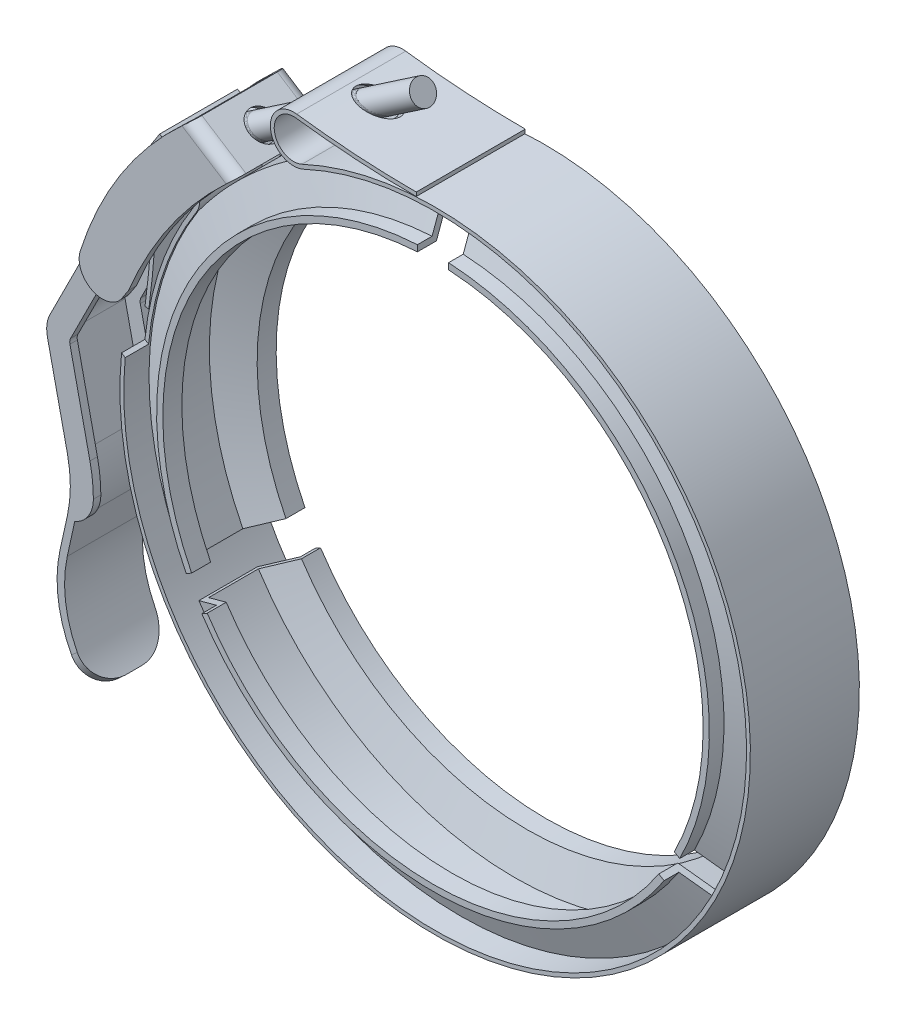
SolidWorks part; units mm, degrees
ref_plane "Front" through (0, 0, 0) normal (0, 0, 1) x (1, 0, 0)
ref_plane "Top" through (0, 0, 0) normal (0, 1, 0) x (1, 0, 0)
ref_plane "Right" through (0, 0, 0) normal (1, 0, 0) x (0, 0, -1)
sketch "Sketch1" plane through (0, 0, 0) normal (1, 0, 0) x (0, 0, -1)
  line L0 (-11.557, 56.3626) -> (-8.5671, 56.3626)
  line L1 (-11.1125, 64.2874) -> (11.1125, 64.2874)
  line L2 (-11.1125, 64.2874) -> (-11.1125, 63.5)
  line L3 (-11.1125, 63.5) -> (-5.9693, 63.5)
  line L4 (8.5671, 56.3626) -> (5.9693, 63.5)
  line L5 (-8.5671, 56.3626) -> (-5.9693, 63.5)
  line L6 (11.1125, 64.2874) -> (11.1125, 63.5)
  line L7 (11.557, 56.3626) -> (8.5671, 56.3626)
  line L8 (5.9693, 63.5) -> (11.1125, 63.5)
  line L9 (0, 0) -> (0, -21.5186) construction
  line L10 (-11.557, 55.0926) -> (-7.6778, 55.0926)
  line L11 (-7.6778, 55.0926) -> (-5.08, 62.23)
  line L12 (-5.08, 62.23) -> (5.08, 62.23)
  line L13 (-7.6778, 55.0926) -> (-4.7934, 63.0174) construction
  line L14 (7.6778, 55.0926) -> (4.7934, 63.0174) construction
  line L15 (-11.557, 56.3626) -> (-11.557, 55.0926)
  line L16 (11.557, 56.3626) -> (11.557, 55.0926)
  line L17 (7.6778, 55.0926) -> (5.08, 62.23)
  line L18 (11.557, 55.0926) -> (7.6778, 55.0926)
  line L19 (-4.7934, 63.0174) -> (4.7934, 63.0174) construction
  line L20 (-4.7934, 63.0174) -> (-4.7934, 63.0174) construction
  line L21 (-4.7934, 63.0174) -> (-4.7934, 63.0174) construction
  line L22 (4.7934, 63.0174) -> (4.7934, 63.0174) construction
  line L23 (4.7934, 63.0174) -> (4.7934, 63.0174) construction
  line L24 (0, 0) -> (-16.4298, 0) construction
  dimension "D2" = 0.7874
  dimension "D3" = 22.225
  dimension "D4" = 1.27
  dimension "D5" = 40
  dimension "D6" = 23.114
  dimension "D7" = 7.1374
  dimension "D8" = 10.16
  dimension "D9" = 62.23
  dimension "D1" = 1.27
revolve "Revolve1" add sketch "Sketch1" angle 360 about L24
sketch "Sketch2" plane through (0, 0, 0) normal (0, 0, 1) x (1, 0, 0)
  line L0 (0, 0) -> (0, 63.4206) construction
  line L1 (0, 0) -> (-54.9238, -31.7103) construction
  line L2 (0, 0) -> (54.9238, -31.7103) construction
  line L3 (-1.5875, 2.7496) -> (-56.5113, -28.9607) construction
  line L4 (-3.175, 1.8331) -> (-56.5113, -28.9607)
  line L5 (0, -3.6662) -> (53.3363, -34.4599)
  line L6 (3.175, 1.8331) -> (3.175, 63.4206)
  line L7 (0, -3.6662) -> (-53.3363, -34.4599)
  line L8 (3.175, 1.8331) -> (56.5113, -28.9607)
  line L9 (-3.175, 1.8331) -> (-3.175, 63.4206)
  line L10 (-3.175, 0) -> (-3.175, 63.4206) construction
  line L11 (3.175, 0) -> (3.175, 63.4206) construction
  line L12 (1.5875, 2.7496) -> (56.5113, -28.9607) construction
  line L13 (-1.5875, -2.7496) -> (53.3363, -34.4599) construction
  line L14 (1.5875, -2.7496) -> (-53.3363, -34.4599) construction
  circle A0 centre (0, 0) radius 63.5 construction
  circle A2 centre (0, 0) radius 63.5 construction
  arc A3 (53.3363, -34.4599) -> (56.5113, -28.9607) centre (0, 0) ccw
  arc A4 (-56.5113, -28.9607) -> (-53.3363, -34.4599) centre (0, 0) ccw
  arc A5 (3.175, 63.4206) -> (-3.175, 63.4206) centre (0, 0) ccw
  dimension "D1" = 120
  dimension "D2" = 120
  dimension "D5" = 3.175
extrude "Cut-Extrude1" cut sketch "Sketch2" against normal mid plane 25.4
sketch "Sketch3" plane through (0, 0, 11.1125) normal (0, 0, 1) x (1, 0, 0)
  line L0 (0, 0) -> (-42.761, 77.141) construction
  line L1 (0, 0) -> (0, 69.6657) construction
  line L2 (-3.8544, 64.2226) -> (-3.8544, 65.01)
  line L3 (0, 63.5) -> (0, 64.2874)
  line L4 (-62.9436, 8.388) -> (-63.7241, 8.492)
  line L5 (-63.151, 12.3029) -> (-63.9315, 12.4069)
  line L6 (0, 0) -> (-28.849, 61.8668) construction
  line L7 (0, 0) -> (-57.5139, 36.7684) construction
  line L8 (0, 0) -> (-66.7293, 8.8925) construction
  circle A0 centre (-28.849, 61.8668) radius 3.9751 construction
  circle A1 centre (0, 0) radius 64.2874 construction
  circle A2 centre (-28.849, 61.8668) radius 4.7625 construction
  circle A3 centre (0, 0) radius 63.5 construction
  arc A4 (0, 64.2874) -> (-27.169, 58.2642) centre (0, 0) ccw
  arc A5 (0, 63.5) -> (-26.8363, 57.5505) centre (0, 0) ccw
  arc A6 (-28.2345, 66.5895) -> (-26.8363, 57.5505) centre (-28.849, 61.8668) ccw
  arc A7 (-28.3361, 65.8087) -> (-27.169, 58.2642) centre (-28.849, 61.8668) ccw
  arc A8 (-28.3361, 65.8087) -> (-3.8544, 64.2226) centre (-3.8544, 253.9591) ccw
  arc A9 (-28.2345, 66.5895) -> (-3.8544, 65.01) centre (-3.8544, 253.9591) ccw
  arc A10 (-62.2764, 36.7832) -> (-63.9315, 12.4069) centre (-251.2245, 37.3676) cw
  arc A11 (-61.489, 36.7807) -> (-63.151, 12.3029) centre (-251.2245, 37.3676) cw
  arc A12 (-61.489, 36.7807) -> (-54.1647, 34.6273) centre (-57.5139, 36.7684) cw
  arc A13 (-62.2764, 36.7832) -> (-53.5013, 34.2032) centre (-57.5139, 36.7684) cw
  arc A14 (-62.9436, 8.388) -> (-53.5013, 34.2032) centre (0, 0) cw
  arc A15 (-63.7241, 8.492) -> (-54.1647, 34.6273) centre (0, 0) cw
  arc A16 (-3.175, 63.4206) -> (-56.5113, -28.9607) centre (0, 0) ccw construction
  dimension "D1" = 9.525
  dimension "D4" = 0.0508
  dimension "D7" = 188.949
  dimension "D6" = 0.0508
  dimension "D5" = 25
  dimension "D2" = 38.1
  dimension "D8" = 25
  dimension "D9" = 3.8532
  dimension "D3" = 0.7874
extrude "Extrude3" add sketch "Sketch3" against normal blind 22.225
sketch "Sketch4" plane through (0, 0, 11.557) normal (0, 0, 1) x (1, 0, 0)
  arc A0 (-29.4542, 57.143) -> (-52.7515, 36.7444) centre (0, 0) ccw construction
  arc A2 (-29.4542, 57.143) -> (-52.7515, 36.7444) centre (0, 0) ccw
  arc A3 (-26.8363, 57.5505) -> (-53.5013, 34.2032) centre (12.416, -14.1804) ccw
  arc A4 (-28.2345, 66.5895) -> (-26.8363, 57.5505) centre (-28.849, 61.8668) ccw construction
  arc A5 (-29.4542, 57.143) -> (-26.8363, 57.5505) centre (-28.849, 61.8668) ccw
  arc A6 (-53.5013, 34.2032) -> (-62.2764, 36.7832) centre (-57.5139, 36.7684) ccw construction
  arc A7 (-53.5013, 34.2032) -> (-52.7515, 36.7444) centre (-57.5139, 36.7684) ccw
extrude "Cut-Extrude2" cut sketch "Sketch4" against normal through all
sketch "Sketch5" plane through (0, 0, 0) normal (0, 0, 1) x (1, 0, 0)
  line L0 (-57.5139, 36.7684) -> (-28.849, 61.8668) construction
  line L1 (-50.3539, 47.2576) -> (-14.4733, 71.6328) construction
  circle A0 centre (-50.3539, 47.2576) radius 3.175
  arc A1 (-54.1647, 34.6273) -> (-61.489, 36.7807) centre (-57.5139, 36.7684) ccw construction
  dimension "D1" = 6.35
  dimension "D2" = 12.7
extrude "Extrude4" add sketch "Sketch5" along normal mid plane 15.875
ref_plane "Plane1" through (-50.3539, 47.2576, 0) normal (0.8272, 0.5619, 0) x (0, 0, -1)
sketch "Sketch6" plane through (-50.3539, 47.2576, 0) normal (0.8272, 0.5619, 0) x (0, 0, -1)
  circle A0 centre (0, 0) radius 2.413
  dimension "D1" = 4.826
extrude "Extrude6" add sketch "Sketch6" along normal blind 44.45 separate body
sketch "Sketch8" plane through (0, 0, 0) normal (0, 0, 1) x (1, 0, 0)
  line L0 (0, 0) -> (-64.2016, 41.0438) construction
  arc A0 (-54.1647, 34.6273) -> (-61.489, 36.7807) centre (-57.5139, 36.7684) ccw construction
  point P3 (-57.5139, 36.7684)
  dimension "D1" = 76.2
ref_plane "Plane2" through (-64.2016, 41.0438, 0) normal (-0.8425, 0.5386, 0) x (0, 0, 1)
sketch "Sketch9" plane through (-64.2016, 41.0438, 0) normal (-0.8425, 0.5386, 0) x (0, 0, 1)
  line L1 (-15.2694, 7.8629) -> (-6.35, 7.8629)
  line L2 (-15.2694, 7.8629) -> (-15.2694, -28.9171)
  line L3 (-15.2694, -28.9171) -> (-6.35, -28.9171)
  line L4 (-6.35, 7.8629) -> (-6.35, -28.9171)
  line L5 (6.35, 7.8629) -> (13.265, 7.8629)
  line L6 (6.35, 7.8629) -> (6.35, -28.9171)
  line L7 (6.35, -28.9171) -> (13.265, -28.9171)
  line L8 (13.265, 7.8629) -> (13.265, -28.9171)
  dimension "D1" = 6.35
  dimension "D2" = 12.7
extrude "Cut-Extrude3" cut sketch "Sketch9" against normal up to surface (13.1887 mm away)
sketch "Sketch7" plane through (0, 0, 0) normal (0, 0, 1) x (1, 0, 0)
  line L0 (-50.3539, 47.2576) -> (-48.077, 49.4704) construction
  line L1 (-51.402, 52.8918) -> (-44.752, 46.049)
  line L2 (-2.5621, -3.2733) -> (-57.5139, 36.7684) construction
  line L4 (-57.5139, 36.7684) -> (-68.9871, 17.7338) construction
  arc A0 (-51.402, 52.8918) -> (-73.528, 19.1699) centre (-2.5621, -3.2733) ccw
  arc A1 (-44.752, 46.049) -> (-64.4463, 16.2978) centre (-2.5621, -3.2733) ccw
  circle A2 centre (-50.3539, 47.2576) radius 3.175 construction
  arc A3 (-73.528, 19.1699) -> (-64.4463, 16.2978) centre (-68.9871, 17.7338) ccw
  dimension "D1" = 9.525
  dimension "D2" = 22.225
  dimension "D3" = 85
sketch "Sketch10" plane through (-64.2016, 41.0438, 0) normal (-0.8425, 0.5386, 0) x (0, 0, 1)
  line L0 (8.4455, -27.0568) -> (8.4455, 15.1072)
  line L1 (7.6835, 15.8692) -> (-7.6835, 15.8692)
  line L2 (-8.4455, 15.1072) -> (-8.4455, -27.0568)
  line L3 (-8.4455, -27.0568) -> (-9.9695, -27.0568)
  line L4 (-9.9695, -27.0568) -> (-9.9695, 15.1072)
  line L5 (-7.6835, 17.3932) -> (7.6835, 17.3932)
  line L6 (9.9695, 15.1072) -> (9.9695, -27.0568)
  line L7 (9.9695, -27.0568) -> (8.4455, -27.0568)
  line L8 (7.9375, 15.8692) -> (-7.9375, 15.8692) construction
  line L9 (7.9375, 9.5192) -> (7.9375, 15.8692) construction
  line L10 (-7.9375, 15.8692) -> (-7.9375, 9.5192) construction
  arc A0 (8.4455, 15.1072) -> (7.6835, 15.8692) centre (7.6835, 15.1072) ccw
  arc A1 (-7.6835, 15.8692) -> (-8.4455, 15.1072) centre (-7.6835, 15.1072) ccw
  arc A2 (-9.9695, 15.1072) -> (-7.6835, 17.3932) centre (-7.6835, 15.1072) cw
  arc A3 (7.6835, 17.3932) -> (9.9695, 15.1072) centre (7.6835, 15.1072) cw
  dimension "D6" = 0.762
  dimension "D7" = 2.286
  dimension "D1" = 1.524
  dimension "D2" = 1.524
  dimension "D3" = 1.524
  dimension "D4" = 0.508
  dimension "D5" = 0.508
  dimension "D8" = 44.45
extrude "Extrude8" add sketch "Sketch10" against normal offset from surface (14.9814 mm away) 0.508 separate body
sketch "Sketch11" plane through (0, 0, 0) normal (0, 0, 1) x (1, 0, 0)
  line L0 (-63.4125, 17.5449) -> (-65.007, 15.1184)
  line L1 (-63.4125, 17.5449) -> (-66.0254, 6.8408)
  line L2 (-49.7124, 54.3175) -> (-53.2569, 63.3341)
  line L3 (-53.2569, 63.3341) -> (-83.453, 18.5168)
  line L4 (-83.453, 18.5168) -> (-66.0254, 6.8408)
  arc A0 (-73.528, 19.1699) -> (-64.4463, 16.2978) centre (-68.9871, 17.7338) ccw construction
  arc A1 (-51.402, 52.8918) -> (-73.528, 19.1699) centre (-2.5621, -3.2733) ccw construction
  arc A2 (-73.528, 19.1699) -> (-65.007, 15.1184) centre (-68.9871, 17.7338) ccw
  arc A3 (-49.7124, 54.3175) -> (-73.528, 19.1699) centre (-2.5621, -3.2733) ccw
extrude "Cut-Extrude4" cut sketch "Sketch11" against normal mid plane 57.15
sketch "Sketch12" plane through (0, 0, 0) normal (0, 0, 1) x (1, 0, 0)
  line L0 (0, 0) -> (-99.1255, 0) construction
  line L1 (0, -60.325) -> (-99.1255, -60.325) construction
  line L2 (-82.2506, -1.3627) -> (-78.1667, -19.949)
  line L3 (-78.1667, -30.851) -> (-79.6856, -37.7636)
  line L4 (-73.6495, -60.325) -> (-72.5232, -59.2984)
  line L5 (-62.7847, 40.5642) -> (-81.7232, 2.8496)
  line L6 (-59.3644, 45.9144) -> (-58.0804, 45.0935)
  line L7 (0, 0) -> (-62.9467, 40.2416) construction
  line L8 (0, 0) -> (-73.528, 19.1699) construction
  line L9 (-62.7847, 40.5642) -> (-59.3644, 45.9144)
  line L10 (-61.4582, 39.8098) -> (-58.0804, 45.0935)
  line L11 (-61.4582, 39.8098) -> (-80.3613, 2.1657)
  line L12 (-80.7621, -1.0357) -> (-76.6782, -19.622)
  line L13 (-76.6782, -31.178) -> (-78.1971, -38.0906)
  arc A0 (-78.1667, -19.949) -> (-78.1667, -30.851) centre (-102.9749, -25.4) cw
  arc A1 (-79.6856, -37.7636) -> (-73.6495, -60.325) centre (-54.8774, -43.2145) ccw
  arc A2 (-80.7621, -1.0357) -> (-80.3613, 2.1657) centre (-76.0485, 0) cw
  arc A3 (-82.2506, -1.3627) -> (-81.7232, 2.8496) centre (-76.0485, 0) cw
  circle A4 centre (0, 0) radius 95.25 construction
  arc A5 (-52.7739, 51.6687) -> (-73.528, 19.1699) centre (-2.5621, -3.2733) ccw construction
  arc A6 (-76.6782, -19.622) -> (-76.6782, -31.178) centre (-102.9749, -25.4) cw
  arc A7 (-78.1971, -38.0906) -> (-72.5232, -59.2984) centre (-54.8774, -43.2145) ccw
  point P5 (-82.55, 0)
  point P13 (-76.969, -25.4)
  point P16 (-82.55, -50.8)
  point P17 (-57.5139, 36.7684)
  dimension "D1" = 190.5
  dimension "D3" = 82.55
  dimension "D5" = 25.4
  dimension "D6" = 6.35
  dimension "D4" = 25.4
  dimension "D7" = 25.4
  dimension "D8" = 6.35
  dimension "D9" = 6.7091
  dimension "D2" = 60.325
  dimension "D10" = 1.524
extrude "Extrude9" add sketch "Sketch12" along normal mid plane 15.875
sketch "Sketch13" plane through (0, 0, 7.9375) normal (0, 0, 1) x (1, 0, 0)
  line L0 (-76.6782, -19.622) -> (-80.7621, -1.0357) construction
  line L1 (-61.4582, 39.8098) -> (-58.0804, 45.0935) construction
  line L2 (-80.3613, 2.1657) -> (-61.4582, 39.8098) construction
  line L3 (-76.6782, -19.622) -> (-80.7621, -1.0357)
  line L4 (-61.4582, 39.8098) -> (-58.0804, 45.0935)
  line L5 (-80.3613, 2.1657) -> (-61.4582, 39.8098)
  arc A0 (-76.6782, -31.178) -> (-76.6782, -19.622) centre (-102.9749, -25.4) ccw construction
  arc A1 (-80.3613, 2.1657) -> (-80.7621, -1.0357) centre (-76.0485, 0) ccw construction
  arc A2 (-76.6782, -31.178) -> (-76.6782, -19.622) centre (-102.9749, -25.4) ccw
  arc A3 (-80.3613, 2.1657) -> (-80.7621, -1.0357) centre (-76.0485, 0) ccw
sketch "Sketch14" plane through (3.6137, 5.6527, 0) normal (0.5386, 0.8425, 0) x (-0.8425, 0.5386, 0)
  line L1 (73.2239, 7.9375) -> (70.0489, 7.9375)
  line L2 (73.2239, 7.9375) -> (73.2239, 6.4135)
  line L3 (73.2239, 6.4135) -> (70.0489, 6.4135)
  line L4 (70.0489, 7.9375) -> (70.0489, 6.4135)
  line L5 (73.2239, -7.9375) -> (70.0489, -7.9375)
  line L6 (73.2239, -7.9375) -> (73.2239, -6.4135)
  line L7 (73.2239, -6.4135) -> (70.0489, -6.4135)
  line L8 (70.0489, -7.9375) -> (70.0489, -6.4135)
  dimension "D1" = 1.524
  dimension "D2" = 3.175
sweep "Sweep1" add profiles "Sketch14" path "Sketch13"
fillet "Fillet2" radius 6.35 4 edges at (-73.0863, -59.8117, -7.9375) (-73.0863, -59.8117, 7.9375) (-73.5772, -31.8594, -7.1755) (-73.5772, -31.8594, 7.1755)
sketch "Sketch15" plane through (24.2812, 16.4952, 0) normal (0.8272, 0.5619, 0) x (0, 0, -1)
  circle A0 centre (0, 67.3863) radius 2.921
  circle A1 centre (0, 67.3863) radius 2.413 construction
  circle A2 centre (0, 67.3863) radius 2.413
  dimension "D1" = 0.508
extrude "Cut-Extrude7" cut sketch "Sketch15" against normal up to surface (43.2057 mm away)
ref_plane "LEVER TIP Plane3" through (0, 0, 0) normal (0.6337, -0.7736, 0) x (0.7736, 0.6337, 0)
equation "\"D4@Sketch1\" = \"D1@Sketch1\""
equation "\"D1@Sketch9\" = \"D2@Sketch9\"/2"
equation "\"D3@Sketch10\" = \"D2@Sketch10\""
equation "\"D5@Sketch10\" = \"D4@Sketch10\""
